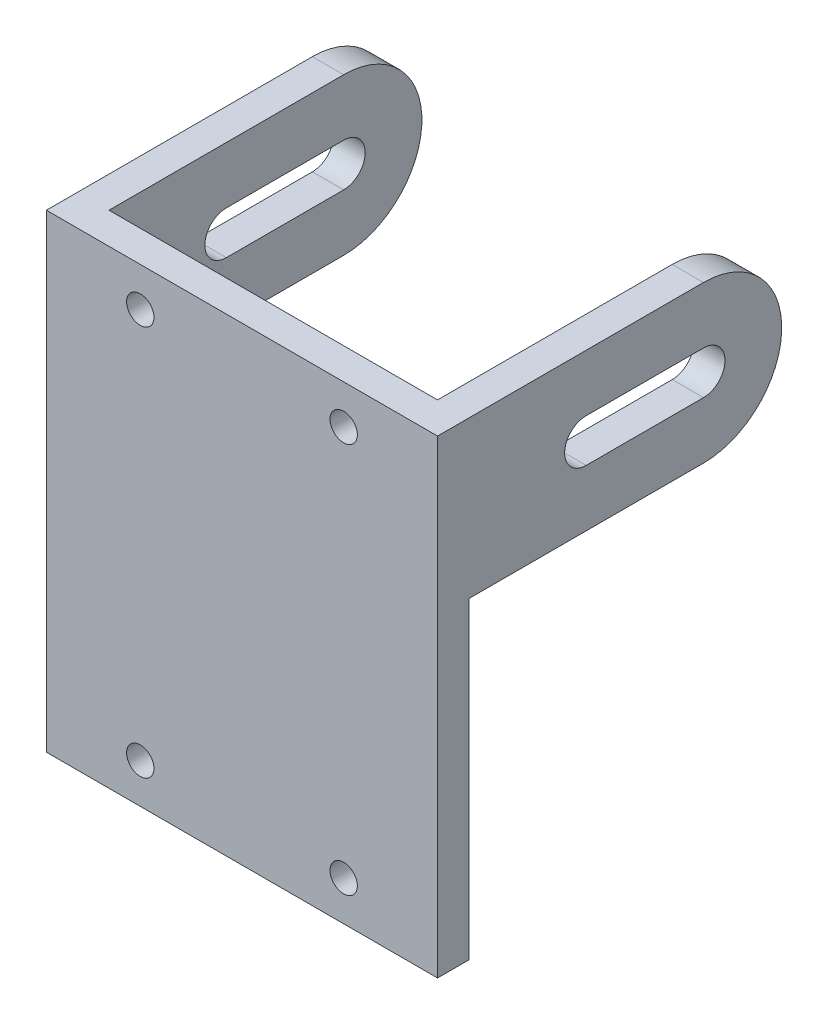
SolidWorks part; units mm, degrees
ref_plane "Ebene vorne" through (0, 0, 0) normal (0, 0, 1) x (1, 0, 0)
ref_plane "Ebene oben" through (0, 0, 0) normal (0, 1, 0) x (1, 0, 0)
ref_plane "Ebene rechts" through (0, 0, 0) normal (1, 0, 0) x (0, 0, -1)
sketch "Skizze1" plane through (0, 0, 0) normal (0, 0, 1) x (1, 0, 0)
  line L0 (25, 0) -> (25, -60) construction
  line L1 (0, 0) -> (50, 0)
  line L2 (0, 0) -> (0, -60)
  line L3 (0, -60) -> (50, -60)
  line L4 (50, 0) -> (50, -60)
  line L5 (0, -30) -> (50, -30) construction
  circle A0 centre (12, -5) radius 1.75
  circle A1 centre (12, -54.9375) radius 1.75
  circle A2 centre (38, -54.9375) radius 1.75
  circle A3 centre (38, -5) radius 1.75
  dimension "D2" = 3.5
  dimension "D3" = 3.5
  dimension "D1" = 26
  dimension "D4" = 26
  dimension "D5" = 50
  dimension "D6" = 60
  dimension "D7" = 5
extrude "Aufsatz-Linear austragen1" add sketch "Skizze1" along normal blind 4
sketch "Skizze4" plane through (0, 0, 0) normal (-1, 0, 0) x (0, 0, 1)
  line L0 (0, 0) -> (-30, 0)
  line L1 (0, -20) -> (-30, -20)
  line L2 (0, 0) -> (0, -60) construction
  line L3 (0, 0) -> (0, -20)
  line L4 (-30, -10) -> (-15, -10) construction
  line L5 (-30, -7.25) -> (-15, -7.25)
  line L6 (-30, -12.75) -> (-15, -12.75)
  arc A1 (-30, 0) -> (-30, -20) centre (-30, -10) ccw
  arc A3 (-30, -7.25) -> (-30, -12.75) centre (-30, -10) ccw
  arc A4 (-15, -12.75) -> (-15, -7.25) centre (-15, -10) ccw
  point P8 (-22.5, -10)
  dimension "D3" = 5.5
  dimension "D1" = 20
  dimension "D2" = 30
  dimension "D4" = 15
extrude "Aufsatz-Linear austragen3" add sketch "Skizze4" against normal blind 4
sketch "Skizze5" plane through (50, 0, 0) normal (1, 0, 0) x (0, 0, -1)
  line L0 (0, 0) -> (0, -20)
  line L1 (0, -20) -> (30, -20)
  line L2 (0, 0) -> (30, 0)
  line L3 (30, -10) -> (15, -10) construction
  line L4 (30, -12.75) -> (15, -12.75)
  line L5 (30, -7.25) -> (15, -7.25)
  arc A0 (30, 0) -> (30, -20) centre (30, -10) cw
  arc A2 (30, -12.75) -> (30, -7.25) centre (30, -10) ccw
  arc A3 (15, -7.25) -> (15, -12.75) centre (15, -10) ccw
  point P4 (22.5, -10)
  dimension "D1" = 5.5
  dimension "D2" = 15
extrude "Aufsatz-Linear austragen4" add sketch "Skizze5" against normal blind 4
